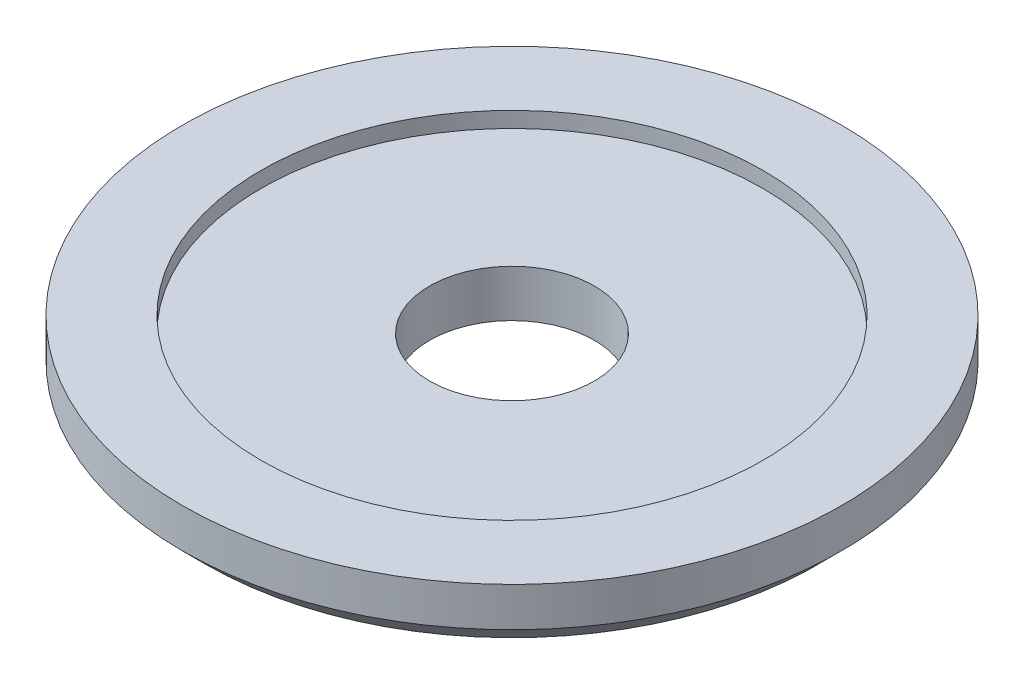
SolidWorks part; units mm, degrees
ref_plane "Front Plane" through (0, 0, 0) normal (0, 0, 1) x (1, 0, 0)
ref_plane "Top Plane" through (0, 0, 0) normal (0, 1, 0) x (1, 0, 0)
ref_plane "Right Plane" through (0, 0, 0) normal (1, 0, 0) x (0, 0, -1)
sketch "Sketch1" plane through (0, 0, 0) normal (0, 1, 0) x (1, 0, 0)
  circle A0 centre (0, 0) radius 21
  circle A1 centre (0, 0) radius 5.25
  dimension "D1" = 42
  dimension "D2" = 10.5
extrude "Boss-Extrude1" add sketch "Sketch1" along normal blind 3
sketch "Sketch2" plane through (0, 3, 0) normal (0, 1, 0) x (1, 0, 0)
  circle A0 centre (0, 0) radius 16
  circle A1 centre (0, 0) radius 21
  dimension "D1" = 32
extrude "Boss-Extrude2" add sketch "Sketch2" along normal blind 1
chamfer "Chamfer1" distance 1.5 angle 45 1 edges at (0, 0, 21)
